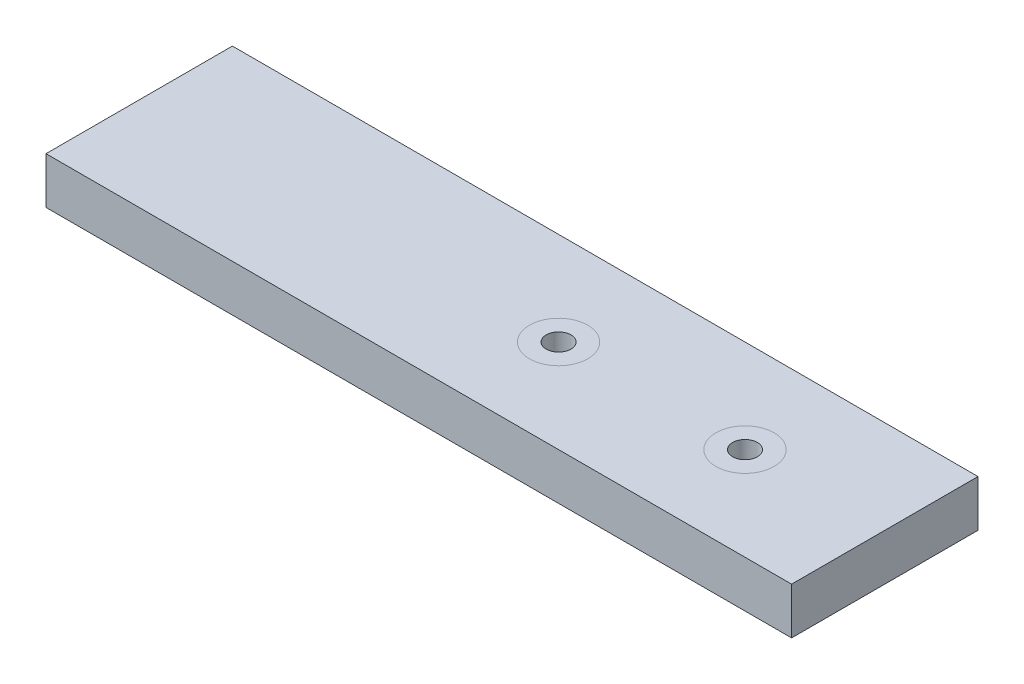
SolidWorks part; units mm, degrees
ref_plane "Front Plane" through (0, 0, 0) normal (0, 0, 1) x (1, 0, 0)
ref_plane "Top Plane" through (0, 0, 0) normal (0, 1, 0) x (1, 0, 0)
ref_plane "Right Plane" through (0, 0, 0) normal (1, 0, 0) x (0, 0, -1)
sketch "Sketch1" plane through (0, 0, 0) normal (0, 1, 0) x (1, 0, 0)
  line L1 (0, -25.4) -> (203.2, -25.4)
  line L2 (0, -25.4) -> (0, 25.4)
  line L3 (0, 25.4) -> (203.2, 25.4)
  line L4 (203.2, -25.4) -> (203.2, 25.4)
  dimension "D1" = 50.8
  dimension "D2" = 203.2
extrude "Extrude1" add sketch "Sketch1" along normal blind 12.7
hole_wizard "CBORE for 1/4 Hex Head Bolt1" positions "Sketch3" profile "Sketch2" counterbore size "1/4" standard "Ansi Inch"
sketch "Sketch3" plane through (0, 12.7, 0) normal (0, 1, 0) x (-1, 0, 0)
  line L0 (-203.2, 0) -> (-101.6793, 0) construction
  line L1 (-203.2, 25.4) -> (-203.2, -25.4) construction
  point P0 (-165.1, 0)
  point P1 (-114.3, 0)
  dimension "D1" = 50.8
  dimension "D2" = 38.1
sketch "Sketch2" plane through (165.1, 12.7, 0) normal (1, 0, 0) x (0, 0, 1)
  line L0 (0, 0) -> (0, 12.7)
  line L1 (0, 12.7) -> (3.3782, 12.7)
  line L3 (3.3782, 12.7) -> (3.3782, 4.7752)
  line L4 (3.3782, 4.7752) -> (9.525, 4.7752)
  line L5 (9.525, 4.7752) -> (9.525, 0)
  line L7 (9.525, 0) -> (0, 0)
  line L11 (0, -6.35) -> (0, 107.95) construction
  dimension "Thru Hole Dia." = 6.7564
  dimension "Thru Hole Depth" = 12.7
  dimension "C'Bore Dia." = 19.05
  dimension "C'Bore Depth" = 4.7752
hole_wizard "1/4 Clearance Hole1" positions "Sketch5" profile "Sketch4" hole size "1/4" standard "Ansi Inch"
sketch "Sketch5" plane through (0, 12.7, 0) normal (0, 1, 0) x (-1, 0, 0)
  line L0 (-203.2, 0) -> (-103.3642, 0) construction
  line L1 (-203.2, 25.4) -> (-203.2, -25.4) construction
  point P0 (-165.1, 0)
  point P1 (-114.3, 0)
  dimension "D1" = 50.8
  dimension "D2" = 38.1
sketch "Sketch4" plane through (165.1, 12.7, 0) normal (1, 0, 0) x (0, 0, 1)
  line L0 (0, 0) -> (0, 12.7)
  line L1 (0, 12.7) -> (3.3782, 12.7)
  line L2 (3.3782, 12.7) -> (3.3782, 0)
  line L5 (3.3782, 0) -> (0, 0)
  line L11 (0, -6.35) -> (0, 107.95) construction
  dimension "Thru Hole Dia." = 6.7564
  dimension "Thru Hole Depth" = 12.7
sketch "Sketch6" plane through (0, 12.7, 0) normal (0, 1, 0) x (1, 0, 0)
  circle A0 centre (114.3, 0) radius 7.9375
  circle A1 centre (114.3, 0) radius 3.3782 construction
  dimension "D1" = 15.875
sketch "Sketch7" plane through (0, 12.7, 0) normal (0, 1, 0) x (1, 0, 0)
  circle A0 centre (165.1, 0) radius 7.9375
  circle A1 centre (114.3, 0) radius 7.9375 construction
  circle A2 centre (165.1, 0) radius 3.3782 construction
